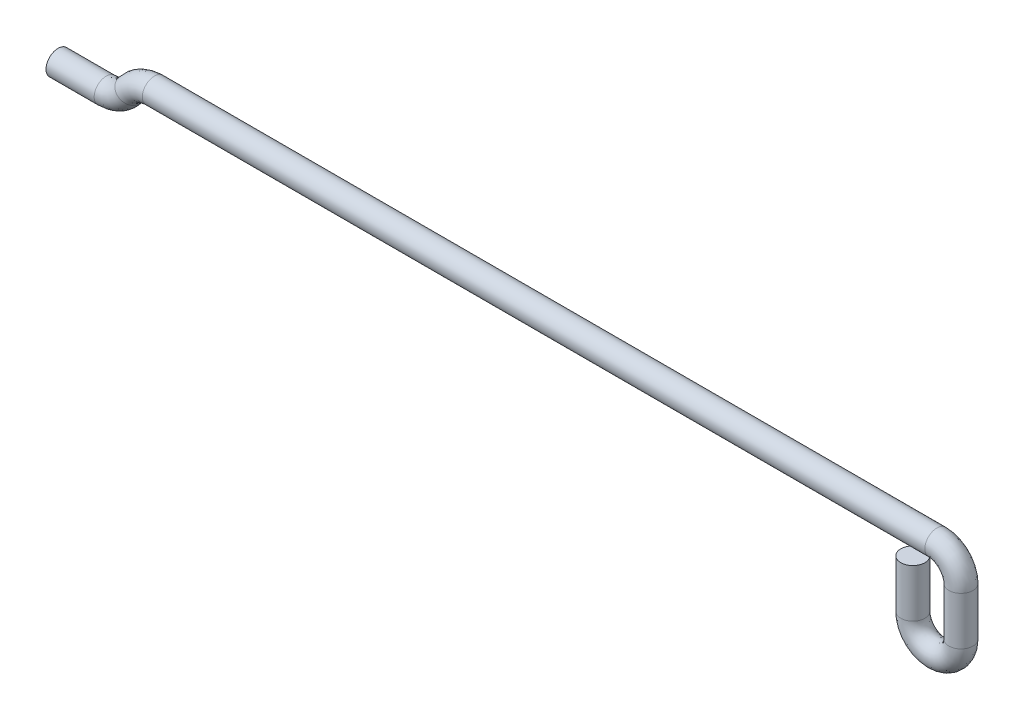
SolidWorks part; units mm, degrees
ref_plane "Front Plane" through (0, 0, 0) normal (0, 0, 1) x (1, 0, 0)
ref_plane "Top Plane" through (0, 0, 0) normal (0, 1, 0) x (1, 0, 0)
ref_plane "Right Plane" through (0, 0, 0) normal (1, 0, 0) x (0, 0, -1)
sketch "Sketch1" plane through (0, 0, 0) normal (0, 0, 1) x (1, 0, 0)
  line L0 (-53.1815, -1.0601) -> (-1.5875, -1.0601)
  line L1 (0, -2.6476) -> (0, -5.8226)
  line L2 (-56.3565, -2.6482) -> (-59.5315, -2.6482)
  line L4 (-3.175, -2.6476) -> (-3.175, -5.8226)
  arc A0 (0, -5.8226) -> (-3.175, -5.8226) centre (-1.5875, -5.8226) cw
  arc A1 (-53.1815, -1.0601) -> (-54.769, -1.8538) centre (-53.1815, -3.0445) ccw
  arc A2 (-54.769, -1.8538) -> (-56.3565, -2.6482) centre (-56.3577, -0.6623) cw
  arc A3 (0, -2.6476) -> (-1.5875, -1.0601) centre (-1.5875, -2.6476) ccw
  dimension "D4" = 4.7625
  dimension "D2" = 1.5875
  dimension "D1" = 3.175
  dimension "D3" = 3.175
  dimension "D5" = 3.175
curve "CompCurve1"
ref_plane "Plane2" through (-59.5315, -2.6482, 0) normal (-1, 0, 0) x (0, 0, 1)
sketch "Sketch3" plane through (-59.5315, -2.6482, 0) normal (-1, 0, 0) x (0, 0, 1)
  circle A0 centre (0, -0.0003) radius 0.7938
  dimension "D1" = 1.5875
sweep "Sweep2" add profiles "Sketch3" path "CompCurve1"
